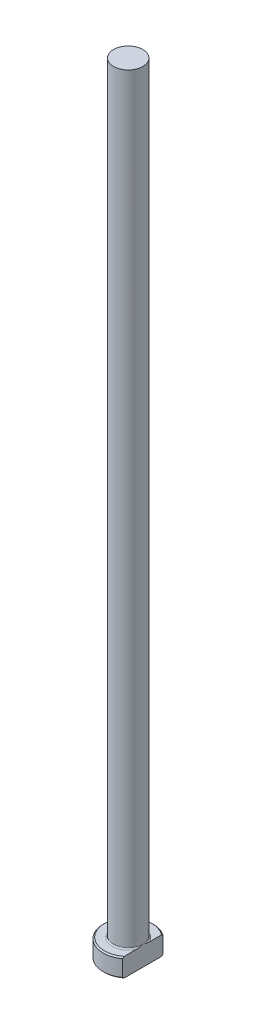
SolidWorks part; units mm, degrees
ref_plane "Front Plane" through (0, 0, 0) normal (0, 0, 1) x (1, 0, 0)
ref_plane "Top Plane" through (0, 0, 0) normal (0, 1, 0) x (1, 0, 0)
ref_plane "Right Plane" through (0, 0, 0) normal (1, 0, 0) x (0, 0, -1)
sketch "Sketch1" plane through (0, 0, 0) normal (0, 0, 1) x (1, 0, 0)
  line L0 (0, 259.9588) -> (0, -15.1925) construction
  line L1 (0, 0) -> (-4, 0)
  line L2 (-4, 0) -> (-4, 3)
  line L3 (-4, 3) -> (-2.35, 3)
  line L4 (-2.35, 3) -> (-2.35, 125)
  line L5 (-2.35, 125) -> (0, 125)
  line L6 (0, 125) -> (0, 0)
  dimension "L" = 125
  dimension "H" = 8
  dimension "T" = 3
  dimension "D" = 4.7
revolve "Revolve1" add sketch "Sketch1" angle 360 about L0
chamfer "Chamfer1" distance 0.2 angle 45 2 edges at (0, 3, 4) (0, 0, 4)
fillet "Fillet1" radius 0.2 1 edges at (0, 3, 2.35)
sketch "Sketch2" plane through (0, 0, 0) normal (0, 1, 0) x (1, 0, 0)
  line L0 (2.35, 3.2369) -> (2.35, -3.2369)
  circle A0 centre (0, 0) radius 4 construction
  arc A1 (2.35, -3.2369) -> (2.35, 3.2369) centre (0, 0) ccw
  circle A2 centre (0, 0) radius 2.35 construction
extrude "KEY" cut sketch "Sketch2" along normal through all
